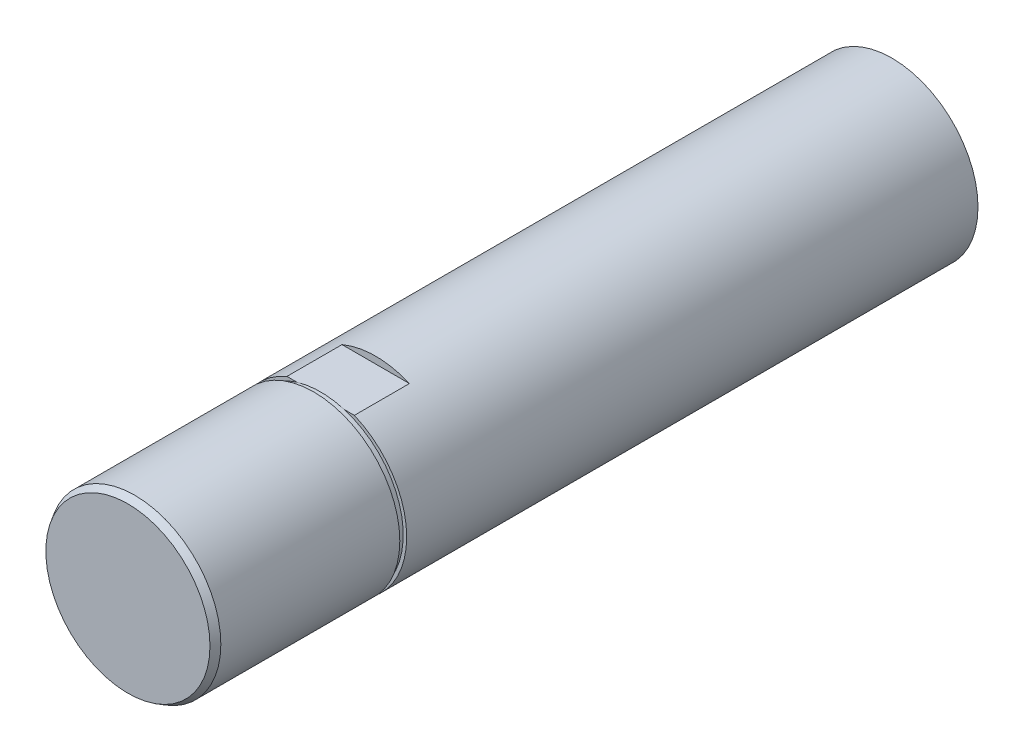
SolidWorks part; units mm, degrees
ref_plane "Front Plane" through (0, 0, 0) normal (0, 0, 1) x (1, 0, 0)
ref_plane "Top Plane" through (0, 0, 0) normal (0, 1, 0) x (1, 0, 0)
ref_plane "Right Plane" through (0, 0, 0) normal (1, 0, 0) x (0, 0, -1)
ref_plane "Plane1" through (0, 0, 8) normal (0, 0, 1) x (1, 0, 0)
sketch "Sketch1" plane through (0, 0, 0) normal (0, 0, 1) x (1, 0, 0)
  circle A0 centre (0, 0) radius 12.5
  dimension "D1" = 25
extrude "STROKE" add sketch "Sketch1" against normal blind 75
sketch "Sketch2" plane through (0, 0, 0) normal (0, 0, 1) x (1, 0, 0)
  circle A0 centre (0, 0) radius 12.5
  dimension "D1" = 25
extrude "L2" add sketch "Sketch2" along normal blind 11
sketch "Sketch3" plane through (0, 0, 8) normal (0, 0, 1) x (1, 0, 0)
  circle A0 centre (0, 0) radius 12.5
  dimension "D1" = 25
extrude "L3" add sketch "Sketch3" along normal blind 28
chamfer "Chamfer2" distance 1 angle 30 1 edges at (12.5, 0, 36)
sketch "Sketch5" plane through (0, 0, 8) normal (0, 0, 1) x (1, 0, 0)
  circle A0 centre (0, 0) radius 12.5
  circle A1 centre (0, 0) radius 12
  circle A4 centre (0, 0) radius 12.5 construction
  dimension "D1" = 25
  dimension "D2" = 24
extrude "U/C" cut sketch "Sketch5" along normal blind 1
sketch "Sketch6" plane through (0, 0, 0) normal (1, 0, 0) x (0, 0, -1)
  line L0 (-36, 11.9226) -> (-36, -11.9226) construction
  line L1 (-8, 13) -> (0, 13)
  line L2 (-8, -11.5) -> (-8, -13)
  line L3 (-8, 11.5) -> (0, 11.5)
  line L4 (0, 13) -> (0, 11.5)
  line L5 (-8, -11.5) -> (0, -11.5)
  line L6 (-8, 13) -> (-8, 11.5)
  line L7 (-8, -13) -> (0, -13)
  line L8 (0, -11.5) -> (0, -13)
  line L9 (75, -12.5) -> (75, 12.5) construction
  line L10 (75, 0) -> (-8, 0) construction
  line L12 (75, 0) -> (-8, 0) construction
  dimension "D1" = 8
  dimension "D2" = 23
  dimension "D3" = 11.5
  dimension "D4" = 28
  dimension "D5" = 26
  dimension "D6" = 25
  dimension "D7" = 13
extrude "A/F" cut sketch "Sketch6" against normal mid plane 21
equation "\"D2@Sketch5\" = \"D1@Sketch5\" - 1"
equation "\"D5@Sketch6\" = \"D2@Sketch6\"+3"
equation "\"D3@Sketch6\" = \"D2@Sketch6\" / 2"
equation "\"D2@Sketch6\" = \"D6@Sketch6\"-2"
equation "\"D7@Sketch6\" = \"D5@Sketch6\"/2"
